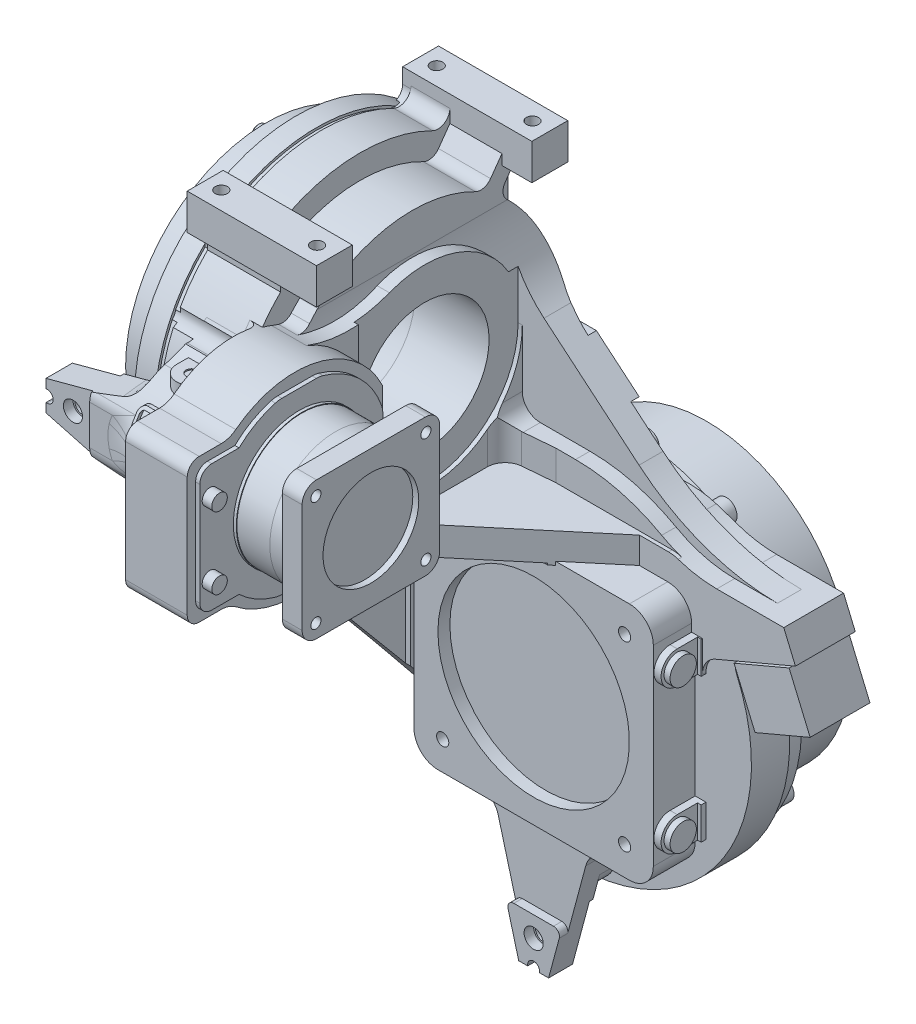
SolidWorks part; units mm, degrees
ref_plane "Piano1 (Front/Back)" through (0, 0, 0) normal (0, 0, 1) x (1, 0, 0)
ref_plane "Piano2 (Top/Bottom)" through (0, 0, 0) normal (0, 1, 0) x (1, 0, 0)
ref_plane "Piano3 (Left/Right)" through (0, 0, 0) normal (1, 0, 0) x (0, 0, -1)
imported_body "Importato1"
sketch "Schizzo1" plane through (27, 0, 0) normal (1, 0, 0) x (0, 0, -1)
  line L0 (-177.9619, 45.9619) -> (-86.0381, -45.9619) construction
  circle A0 centre (-132, 0) radius 40
  dimension "D1" = 80
extrude "Taglio-Estrusione1" cut sketch "Schizzo1" against normal blind 5
